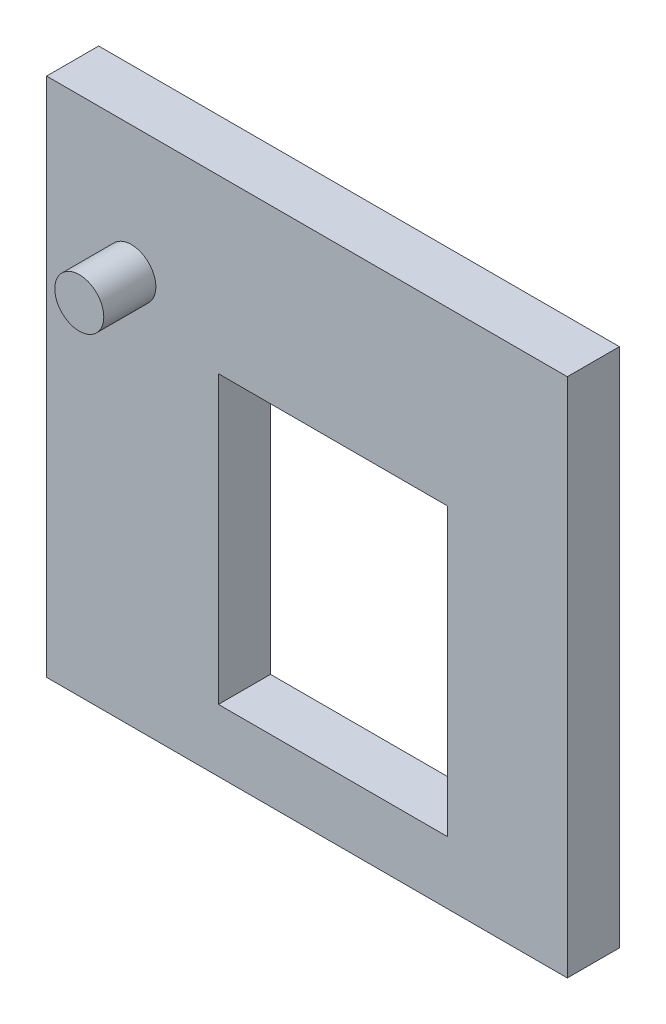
SolidWorks part; units mm, degrees
ref_plane "Vorne" through (0, 0, 0) normal (0, 0, 1) x (1, 0, 0)
ref_plane "Oben" through (0, 0, 0) normal (0, 1, 0) x (1, 0, 0)
ref_plane "Rechts" through (0, 0, 0) normal (1, 0, 0) x (0, 0, -1)
sketch "Skizze1" plane through (0, 0, 0) normal (0, 0, -1) x (-1, 0, 0)
  line L0 (-50, -50) -> (-50, 50)
  line L1 (0, 50) -> (0, 0) construction
  line L2 (0, 0) -> (-50, 0) construction
  line L3 (50, 50) -> (50, -50)
  line L4 (50, -50) -> (-50, -50)
  line L5 (50, 50) -> (-50, 50)
  dimension "D2" = 100
  dimension "D3" = 100
extrude "Linear austragen1" add sketch "Skizze1" along normal mid plane 10
sketch "Fehlerskizze" plane through (0, 0, 5) normal (0, 0, 1) x (1, 0, 0)
  line L0 (-50, -50) -> (-50, 50) construction
  line L1 (-17, -38) -> (27, -38)
  line L2 (-17, -38) -> (-17, 17)
  line L3 (-17, 17) -> (27, 17)
  line L4 (27, -38) -> (27, 17)
  line L5 (-50, 50) -> (50, 50) construction
  dimension "D1" = 33
  dimension "D2" = 44
  dimension "D3" = 33
  dimension "D4" = 55
extrude "Fehlerfeature" cut sketch "Fehlerskizze" against normal through all
sketch "Skizze5" plane through (0, 0, 5) normal (0, 0, 1) x (1, 0, 0)
  circle A0 centre (-33.7211, 25.4187) radius 4.7028
extrude "Linear austragen3" add sketch "Skizze5" along normal blind 10
